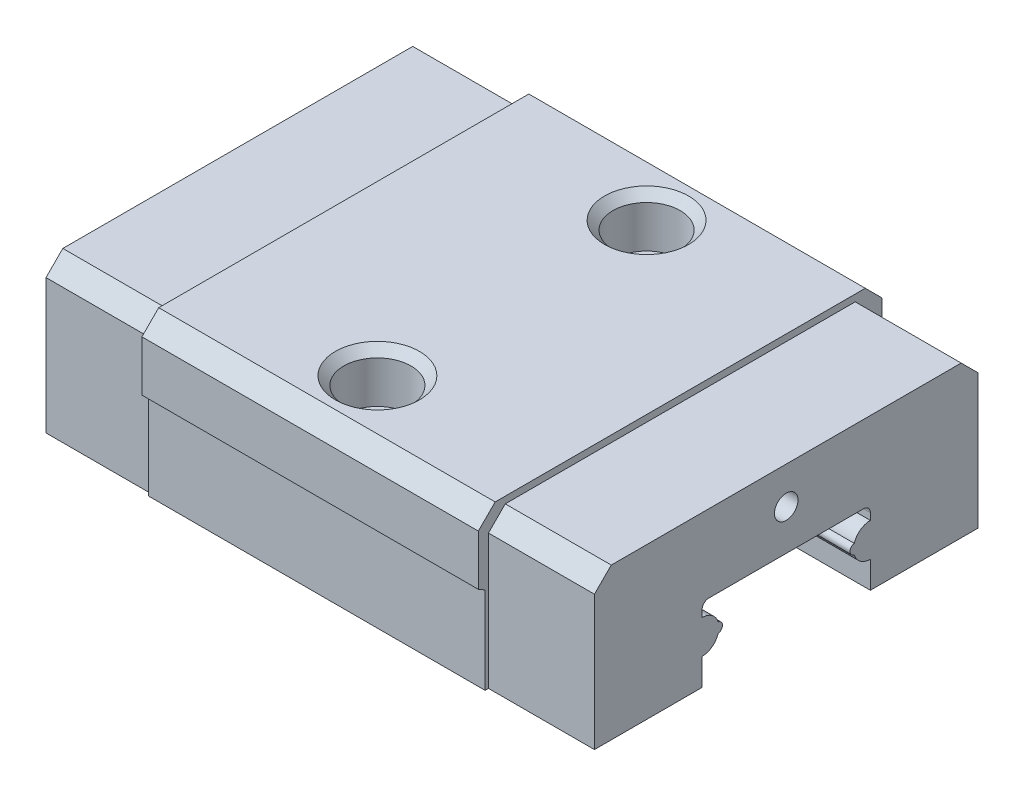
SolidWorks part; units mm, degrees
ref_plane "前基準面" through (0, 0, 0) normal (0, 0, 1) x (1, 0, 0)
ref_plane "上基準面" through (0, 0, 0) normal (0, 1, 0) x (1, 0, 0)
ref_plane "右基準面" through (0, 0, 0) normal (1, 0, 0) x (0, 0, -1)
sketch "草圖1" plane through (0, 0, 0) normal (1, 0, 0) x (0, 0, -1)
  line L0 (-2, 0) -> (-2.5, 0.5)
  line L1 (2, 0) -> (-2, 0)
  line L2 (2.5, 0.5) -> (2.5, 3.5)
  line L3 (2.5, 3.5) -> (-2.5, 3.5)
  line L4 (-2.5, 0.5) -> (-2.5, 3.5)
  line L5 (0, 3.5) -> (0, 2.0812) construction
  line L6 (2, 0) -> (2.5, 0.5)
  dimension "D1" = 5
  dimension "D2" = 3.5
  dimension "D3" = 45
  dimension "D4" = 0.5
extrude "Extrude2" add sketch "草圖1" against normal blind 25
hole_wizard "HoleWzd1" positions "草圖3" profile "草圖2" counterbore size "M2.5" standard "ISO"
sketch "草圖3" plane through (0, 3.5, 0) normal (0, 1, 0) x (-1, 0, 0)
  line L1 (0, -2.5) -> (0, 2.5) construction
  line L2 (25, -2.5) -> (0, -2.5) construction
  point P0 (5, 0)
  dimension "D1" = 2.5
  dimension "D2" = 5
sketch "草圖2" plane through (-5, 3.5, 0) normal (1, 0, 0) x (0, 0, 1)
  line L0 (0, 0) -> (0, 3.5)
  line L1 (1.2, 3.3) -> (1.4, 3.5)
  line L2 (1.75, 1) -> (1.2, 1)
  line L3 (1.2, 1) -> (1.2, 3.3)
  line L5 (1.75, 1) -> (1.75, 0.25)
  line L6 (1.75, 0.25) -> (2, 0)
  line L7 (2, 0) -> (0, 0)
  line L8 (-1.75, 0.25) -> (-2, 0) construction
  line L11 (0, -6.35) -> (0, 107.95) construction
  line L12 (1.4, 3.5) -> (0, 3.5)
  line L13 (-1.2, 3.3) -> (-1.4, 3.5) construction
  dimension "貫穿孔直徑" = 2.4
  dimension "貫穿孔深度" = 3.5
  dimension "柱孔直徑" = 3.5
  dimension "柱孔深度" = 1
  dimension "近端錐孔直徑" = 4
  dimension "近端錐孔角度" = 90
  dimension "遠端錐孔直徑" = 2.8
  dimension "遠端錐孔角度" = 90
ref_plane "Plane1" through (-15, 0, 0) normal (1, 0, 0) x (0, 0, -1)
sketch "草圖4" plane through (-15, 0, 0) normal (1, 0, 0) x (0, 0, -1)
  line L0 (0, 0) -> (0, 7.0094) construction
  line L1 (-5.5, 6) -> (-2.5, 6)
  line L2 (-6, 5.5) -> (-6, 4)
  line L3 (-5.8, 1.3) -> (5.8, 1.3)
  line L4 (6, 5.5) -> (6, 4)
  line L5 (-2, 0) -> (2, 0) construction
  line L6 (5.5, 6) -> (6, 5.5)
  line L7 (-5.5, 6) -> (-6, 5.5)
  line L8 (-5.8, 1.3) -> (-5.8, 3.8845)
  line L9 (-6, 4) -> (-5.8, 3.8845)
  line L10 (-2.5, 6) -> (5.5, 6)
  line L11 (6, 4) -> (5.8, 3.8845)
  line L12 (5.8, 1.3) -> (5.8, 3.8845)
  dimension "D1" = 45
  dimension "D2" = 4.7
  dimension "D3" = 6
  dimension "D4" = 0.5
  dimension "D5" = 12
  dimension "D6" = 0.2
  dimension "D7" = 60
  dimension "D8" = 2
extrude "Extrude3" add sketch "草圖4" against normal blind 5 and the other way blind 5
sketch "草圖5" plane through (-20, 0, 0) normal (-1, 0, 0) x (0, 0, 1)
  line L0 (-2.5, 1.3) -> (-5.8, 1.3) construction
  line L1 (-5.7, 1.3) -> (5.7, 1.3)
  line L2 (-5.7, 1.3) -> (-5.7, 5.3)
  line L3 (-5.2, 5.8) -> (5.2, 5.8)
  line L4 (5.7, 1.3) -> (5.7, 5.3)
  line L6 (5.2, 5.8) -> (5.7, 5.3)
  line L7 (0, 0) -> (0, 5.8574) construction
  line L8 (-5.2, 5.8) -> (-5.7, 5.3)
  line L9 (-5.5, 6) -> (5.5, 6) construction
  dimension "D1" = 0.2
  dimension "D2" = 45
  dimension "D3" = 0.5
  dimension "D4" = 11.4
extrude "Extrude4" add sketch "草圖5" along normal blind 3.15
sketch "草圖6" plane through (-23.15, 0, 0) normal (-1, 0, 0) x (0, 0, 1)
  line L0 (-5.5, 6) -> (5.5, 6) construction
  line L1 (0, 0) -> (0, 4.6787) construction
  circle A0 centre (0, 4.7) radius 0.35
  dimension "D1" = 0.7
  dimension "D2" = 1.3
extrude "Cut-Extrude1" cut sketch "草圖6" against normal blind 2
mirror "Mirror1" about plane through (-15, 0, 0) normal (1, 0, 0) of "Cut-Extrude1", "Extrude4"
hole_wizard "M2x0.4 Tapped Hole1" positions "草圖10" profile "草圖9" tap size "M2x0.4" standard "ISO"
sketch "草圖10" plane through (0, 6, 0) normal (0, 1, 0) x (-1, 0, 0)
  line L1 (15, -4) -> (15, 4) construction
  line L2 (20, -6) -> (10, -6) construction
  line L4 (15, -5.5) -> (15, -14.3737) construction
  line L5 (20, -5.5) -> (10, -5.5) construction
  point P0 (15, -4)
  point P4 (15, 4)
  dimension "D3" = 8
  dimension "D4" = 2
sketch "草圖9" plane through (-15, 6, -4) normal (1, 0, 0) x (0, 0, 1)
  line L0 (0, 0) -> (0, 2.9807)
  line L1 (0, 2.9807) -> (0.8, 2.5)
  line L2 (0.8, 2.5) -> (0.8, 1.5)
  line L3 (0.8, 1.5) -> (1, 1.5)
  line L5 (1, 1.5) -> (1, 0.25)
  line L6 (1, 0.25) -> (1.25, 0)
  line L7 (1.25, 0) -> (0, 0)
  line L8 (-1, 0.25) -> (-1.25, 0) construction
  line L10 (0, 2.9807) -> (-0.8, 2.5) construction
  line L11 (0, -6.35) -> (0, 107.95) construction
  dimension "螺孔鑽直徑" = 1.6
  dimension "螺孔鑽深度" = 2.5
  dimension "螺紋主直徑" = 2
  dimension "螺紋深度" = 1.5
  dimension "近端錐孔直徑" = 2.5
  dimension "近端錐孔角度" = 90
  dimension "導頭角度" = 118
pattern_linear "LPattern1" count 2 spacing 15 along (-1, 0, 0) of "HoleWzd1"
sketch "草圖11" plane through (-6.85, 0, 0) normal (1, 0, 0) x (0, 0, -1)
  line L6 (-2.5, 3.5) -> (-2.5, 0.5)
  line L7 (-2.5, 0.5) -> (-2, 0)
  line L8 (-2, 0) -> (2, 0)
  line L9 (2, 0) -> (2.5, 0.5)
  line L10 (2.5, 0.5) -> (2.5, 3.5)
  line L11 (2.5, 3.5) -> (-2.5, 3.5)
  line L12 (-2.5, 3.5) -> (-2.5, 0.5)
  line L13 (-2.5, 0.5) -> (-2, 0)
  line L14 (-2, 0) -> (2, 0)
  line L15 (2, 0) -> (2.5, 0.5)
  line L16 (2.5, 0.5) -> (2.5, 3.5)
  line L17 (2.5, 3.5) -> (-2.5, 3.5)
  dimension "D1" = 0
extrude "Cut-Extrude4" cut sketch "草圖11" against normal through all and the other way through all
sketch "Sketch1" plane through (-6.85, 0, 0) normal (1, 0, 0) x (0, 0, -1)
  line L0 (2.0453, 2.6) -> (2.2019, 2.6) construction
  line L1 (5.5, 6) -> (-5.5, 6) construction
  line L4 (-3.1477, 0) -> (2.3315, 0) construction
  line L5 (0, 3.1997) -> (0, 0) construction
  line L6 (-2.5, 3.5) -> (-2.5, 1.3) construction
  line L8 (2.5, 1.3) -> (2.5, 3.5) construction
  arc A0 (2.0225, 2.7483) -> (2.0225, 2.4517) centre (2.0453, 2.6) ccw
  arc A1 (2.0225, 2.4517) -> (2.0225, 2.7483) centre (2.5, 2.6) ccw
  arc A2 (-2.0225, 2.7483) -> (-2.0225, 2.4517) centre (-2.0453, 2.6) cw
  arc A3 (-2.0225, 2.4517) -> (-2.0225, 2.7483) centre (-2.5, 2.6) cw
  dimension "D1" = 0.3
  dimension "D2" = 1
  dimension "D3" = 0.4547
  dimension "D5" = 6
  dimension "D4" = 2.6
extrude "Extrude1" add sketch "Sketch1" against normal through all
fillet "Fillet1" radius 0.2 2 edges at (-15, 3.5, -2.5) (-15, 3.5, 2.5)
sketch "草圖14" plane through (0, 0, -5.8) normal (0, 0, -1) x (-1, 0, 0)
